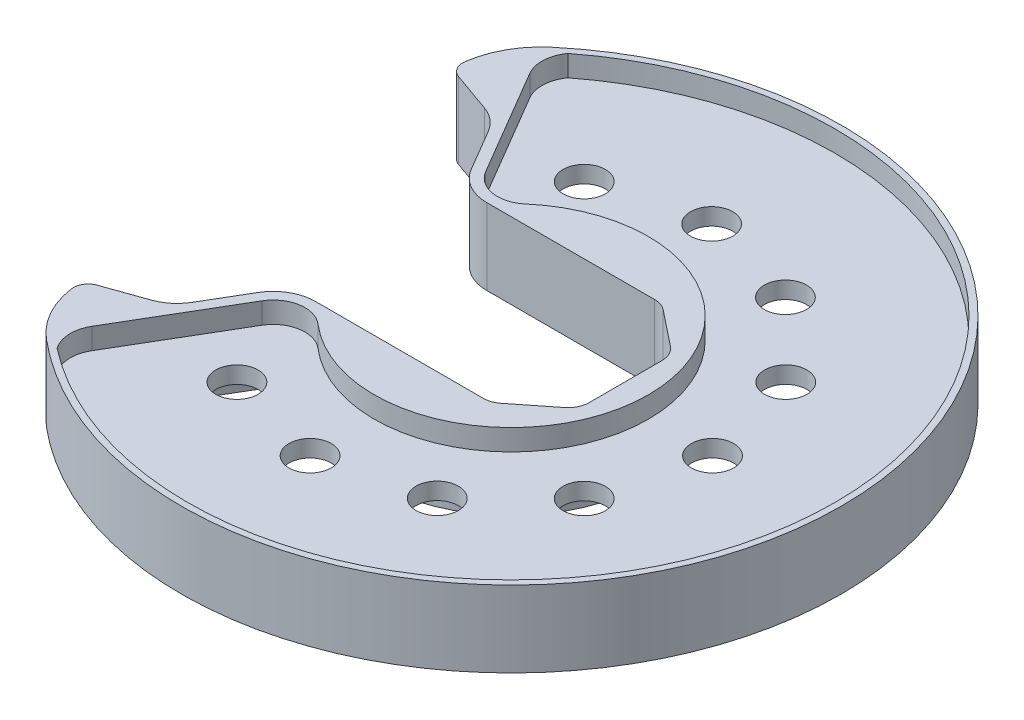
SolidWorks part; units mm, degrees
other "<lowerBatteryTray>-<#10 (0.1935) Diameter Hole1>"
ref_plane "Front Plane" through (0, 0, 0) normal (0, 0, 1) x (1, 0, 0)
ref_plane "Top Plane" through (0, 0, 0) normal (0, 1, 0) x (1, 0, 0)
ref_plane "Right Plane" through (0, 0, 0) normal (1, 0, 0) x (0, 0, -1)
ref_plane "Front Plane-lowerBatteryTray_Mirrored" through (0, 0, 0) normal (0, 0, 1) x (1, 0, 0)
ref_plane "Top Plane-lowerBatteryTray_Mirrored" through (0, 0, 0) normal (0, -1, 0) x (1, 0, 0)
ref_plane "Right Plane-lowerBatteryTray_Mirrored" through (0, 0, 0) normal (1, 0, 0) x (0, 0, -1)
sketch "Sketch1-lowerBatteryTray_Mirrored" plane through (0, 0, 0) normal (0, 1, 0) x (1, 0, 0)
  line L0 (0, 0) -> (34.29, 0) construction
  line L8 (34.29, -13.97) -> (34.29, 13.97)
  line L12 (19.5169, 25.7024) -> (34.29, 13.97)
  line L15 (19.5169, -25.7024) -> (-33.0714, -25.7024)
  line L16 (19.5169, -25.7024) -> (34.29, -13.97)
  line L18 (19.5169, 25.7024) -> (-33.0714, 25.7024)
  line L20 (-67.7301, 72.2877) -> (-44.019, 31.9649)
  line L22 (-67.7301, -72.2877) -> (-44.019, -31.9649)
  line L24 (-59.5332, 66.1151) -> (-42.881, 37.7966) construction
  line L25 (-60.19, 65.7288) -> (-41.2821, 33.5742)
  line L26 (-60.19, -65.7288) -> (-41.2821, -33.5742)
  line L27 (41.155, 0) -> (97.155, 0) construction
  arc A0 (-67.7301, -72.2877) -> (-67.7301, 72.2877) centre (0, 0) ccw
  arc A3 (-59.6737, 76.669) -> (-59.6737, -76.669) centre (0, 0) cw
  arc A4 (-49.772, 48.0121) -> (-49.772, -48.0121) centre (0, 0) cw construction
  arc A5 (-26.8559, 31.1849) -> (-41.2821, 33.5742) centre (-33.0714, 38.4024) cw
  arc A6 (-44.019, 31.9649) -> (-33.0714, 25.7024) centre (-33.0714, 38.4024) ccw
  arc A11 (-44.019, -31.9649) -> (-33.0714, -25.7024) centre (-33.0714, -38.4024) cw
  arc A14 (-59.6737, 76.669) -> (-60.19, 65.7288) centre (-51.5596, 70.8038) ccw
  arc A16 (-41.2821, -33.5742) -> (-26.8559, -31.1849) centre (-33.0714, -38.4024) cw
  arc A17 (-59.6737, -76.669) -> (-60.19, -65.7288) centre (-51.5596, -70.8038) cw
  arc A18 (-26.8559, 31.1849) -> (-26.8559, -31.1849) centre (0, 0) cw
  point P23 (-33.0714, -25.4)
  point P24 (-33.0714, -25.4)
  point P48 (69.155, 0)
  dimension "D1" = 198.12
  dimension "D4" = 34.29
  dimension "D5" = 1.905
  dimension "D6" = 9.525
  dimension "D11" = 56
  dimension "D3" = 27.94
  dimension "D8" = 0.762
  dimension "D9" = 3.175
  dimension "D13" = 56
  dimension "D14" = 8.89
sketch "Sketch4-lowerBatteryTray_Mirrored" plane through (0, 0, 0) normal (0, -1, 0) x (1, 0, 0)
  line L8 (19.5169, -25.7024) -> (-33.0714, -25.7024)
  line L10 (-33.0714, 25.7024) -> (19.5169, 25.7024)
  line L39 (19.5169, 25.7024) -> (34.29, 13.97)
  line L40 (34.29, 13.97) -> (34.29, -13.97)
  line L41 (34.29, -13.97) -> (19.5169, -25.7024)
  line L44 (-44.019, -31.9649) -> (-67.7301, -72.2877)
  line L45 (-67.7301, 72.2877) -> (-44.019, 31.9649)
  arc A4 (-33.0714, -25.7024) -> (-44.019, -31.9649) centre (-33.0714, -38.4024) ccw
  arc A6 (-44.019, 31.9649) -> (-33.0714, 25.7024) centre (-33.0714, 38.4024) ccw
  arc A19 (-67.7301, -72.2877) -> (-67.7301, 72.2877) centre (0, 0) ccw
sketch "Sketch5-lowerBatteryTray_Mirrored" plane through (0, -16.51, 0) normal (0, 1, 0) x (1, 0, 0)
  line L0 (-70.0632, 54.2298) -> (-58.0703, 49.9846)
  line L2 (-51.3606, 44.45) -> (-65.0836, 67.787)
  arc A3 (-72.9842, 59.0206) -> (-63.6926, 75.8692) centre (-46.5184, 55.4117) cw
  arc A4 (-58.0703, 49.9846) -> (-51.3606, 44.45) centre (-62.3082, 38.0125) cw
  arc A5 (-63.6926, 75.8692) -> (-65.0836, 67.787) centre (-59.6098, 71.0058) ccw
  arc A7 (-72.9842, 59.0206) -> (-70.0632, 54.2298) centre (-68.58, 58.42) ccw
  point P6 (-62.4537, 75.8692)
  point P11 (-73.025, 58.42)
  point P13 (-64.8838, 67.4473)
  dimension "D1" = 4.445
  dimension "D3" = 12.7
mirrored part "lowerBatteryTray_Mirrored"
sketch "Sketch4" plane through (0, 0, 0) normal (0, 1, 0) x (1, 0, 0)
  line L11 (-33.0714, 25.7024) -> (17.3021, 25.7024)
  line L12 (-33.0714, 25.7024) -> (17.3021, 25.7024)
  line L13 (-58.0703, -49.9846) -> (-70.0632, -54.2298)
  line L17 (-58.0703, -49.9846) -> (-70.0632, -54.2298)
  line L18 (-70.0632, 54.2298) -> (-58.0703, 49.9846)
  line L19 (-70.0632, 54.2298) -> (-58.0703, 49.9846)
  line L20 (-41.2821, -33.5742) -> (-60.19, -65.7288)
  line L21 (-60.19, 65.7288) -> (-41.2821, 33.5742)
  line L22 (-41.2821, -33.5742) -> (-60.19, -65.7288)
  line L23 (-60.19, 65.7288) -> (-41.2821, 33.5742)
  line L24 (17.3021, -25.7024) -> (-33.0714, -25.7024)
  line L25 (31.8891, -15.8767) -> (21.2513, -24.325)
  line L26 (17.3021, -25.7024) -> (-33.0714, -25.7024)
  line L37 (-44.019, -31.9649) -> (-51.3606, -44.45)
  line L41 (-44.019, -31.9649) -> (-51.3606, -44.45)
  line L43 (-51.3606, 44.45) -> (-44.019, 31.9649)
  line L44 (21.2513, 24.325) -> (31.8891, 15.8767)
  line L45 (34.29, 10.9041) -> (34.29, -10.9041)
  line L46 (31.8891, -15.8767) -> (21.2513, -24.325)
  line L53 (21.2513, 24.325) -> (31.8891, 15.8767)
  line L54 (34.29, 10.9041) -> (34.29, -10.9041)
  line L55 (-51.3606, 44.45) -> (-44.019, 31.9649)
  arc A6 (-41.2821, 33.5742) -> (-26.8559, 31.1849) centre (-33.0714, 38.4024) ccw
  arc A7 (-41.2821, 33.5742) -> (-26.8559, 31.1849) centre (-33.0714, 38.4024) ccw
  arc A12 (-44.019, 31.9649) -> (-33.0714, 25.7024) centre (-33.0714, 38.4024) ccw
  arc A13 (-44.019, 31.9649) -> (-33.0714, 25.7024) centre (-33.0714, 38.4024) ccw
  arc A17 (-33.0714, -25.7024) -> (-44.019, -31.9649) centre (-33.0714, -38.4024) ccw
  arc A18 (-33.0714, -25.7024) -> (-44.019, -31.9649) centre (-33.0714, -38.4024) ccw
  arc A19 (-63.6926, -75.8692) -> (-63.6926, 75.8692) centre (0, 0) ccw
  arc A22 (-63.6926, -75.8692) -> (-63.6926, 75.8692) centre (0, 0) ccw
  arc A34 (-70.0632, -54.2298) -> (-72.9842, -59.0206) centre (-68.58, -58.42) ccw
  arc A37 (-70.0632, -54.2298) -> (-72.9842, -59.0206) centre (-68.58, -58.42) ccw
  arc A39 (-58.0703, -49.9846) -> (-51.3606, -44.45) centre (-62.3082, -38.0125) ccw
  arc A41 (-58.0703, -49.9846) -> (-51.3606, -44.45) centre (-62.3082, -38.0125) ccw
  arc A42 (-72.9842, 59.0206) -> (-70.0632, 54.2298) centre (-68.58, 58.42) ccw
  arc A44 (-72.9842, 59.0206) -> (-70.0632, 54.2298) centre (-68.58, 58.42) ccw
  arc A46 (-59.6737, 76.669) -> (-60.19, 65.7288) centre (-51.5596, 70.8038) ccw
  arc A47 (-59.6737, -76.669) -> (-59.6737, 76.669) centre (0, 0) ccw
  arc A48 (-60.19, -65.7288) -> (-59.6737, -76.669) centre (-51.5596, -70.8038) ccw
  arc A49 (-26.8559, -31.1849) -> (-41.2821, -33.5742) centre (-33.0714, -38.4024) ccw
  arc A50 (-26.8559, -31.1849) -> (-26.8559, 31.1849) centre (0, 0) ccw
  arc A52 (-59.6737, 76.669) -> (-60.19, 65.7288) centre (-51.5596, 70.8038) ccw
  arc A53 (-59.6737, -76.669) -> (-59.6737, 76.669) centre (0, 0) ccw
  arc A54 (-60.19, -65.7288) -> (-59.6737, -76.669) centre (-51.5596, -70.8038) ccw
  arc A55 (-26.8559, -31.1849) -> (-41.2821, -33.5742) centre (-33.0714, -38.4024) ccw
  arc A56 (-26.8559, -31.1849) -> (-26.8559, 31.1849) centre (0, 0) ccw
  arc A60 (21.2513, 24.325) -> (17.3021, 25.7024) centre (17.3021, 19.3524) ccw
  arc A62 (-51.3606, 44.45) -> (-58.0703, 49.9846) centre (-62.3082, 38.0125) ccw
  arc A63 (-51.3606, 44.45) -> (-58.0703, 49.9846) centre (-62.3082, 38.0125) ccw
  arc A65 (21.2513, 24.325) -> (17.3021, 25.7024) centre (17.3021, 19.3524) ccw
  arc A67 (17.3021, -25.7024) -> (21.2513, -24.325) centre (17.3021, -19.3524) ccw
  arc A69 (34.29, 10.9041) -> (31.8891, 15.8767) centre (27.94, 10.9041) ccw
  arc A70 (34.29, 10.9041) -> (31.8891, 15.8767) centre (27.94, 10.9041) ccw
  arc A71 (31.8891, -15.8767) -> (34.29, -10.9041) centre (27.94, -10.9041) ccw
  arc A72 (31.8891, -15.8767) -> (34.29, -10.9041) centre (27.94, -10.9041) ccw
  arc A73 (17.3021, -25.7024) -> (21.2513, -24.325) centre (17.3021, -19.3524) ccw
  arc A79 (-72.9842, -59.0206) -> (-63.6926, -75.8692) centre (-46.5184, -55.4117) ccw
  arc A80 (-72.9842, -59.0206) -> (-63.6926, -75.8692) centre (-46.5184, -55.4117) ccw
  arc A81 (-63.6926, 75.8692) -> (-72.9842, 59.0206) centre (-46.5184, 55.4117) ccw
  arc A82 (-63.6926, 75.8692) -> (-72.9842, 59.0206) centre (-46.5184, 55.4117) ccw
  dimension "D1" = 0
  dimension "D2" = 0
extrude "Boss-Extrude1" add sketch "Sketch4" along normal blind 6.35
sketch "Sketch5" plane through (0, 0, 0) normal (0, 1, 0) x (1, 0, 0)
  line L0 (-25.6444, 44.2686) -> (-34.857, 59.9809) construction
  line L1 (-0.0744, 51.1599) -> (-0.1966, 69.3735) construction
  line L2 (25.5155, 44.343) -> (34.5165, 60.1775) construction
  line L3 (44.2686, 25.6444) -> (59.9809, 34.857) construction
  line L4 (51.1599, 0.0744) -> (69.3735, 0.1966) construction
  line L5 (0, 0) -> (-32.942, 0) construction
  circle A0 centre (-30.2507, 52.1247) radius 6.35
  arc A4 (-32.942, 39.143) -> (-17.5677, 48.0492) centre (0, 0) cw construction
  arc A5 (-42.3879, 54.918) -> (-26.7297, 64.0175) centre (0, 0) cw construction
  arc A6 (-26.8559, -31.1849) -> (-26.8559, 31.1849) centre (0, 0) ccw construction
  arc A7 (-9.25, 68.7543) -> (8.8601, 68.8056) centre (0, 0) cw construction
  circle A8 centre (-0.1355, 60.2667) radius 6.35
  circle A9 centre (30.016, 52.2603) radius 6.35
  arc A10 (17.4278, 48.1001) -> (32.828, 39.2386) centre (0, 0) cw construction
  arc A11 (26.3664, 64.168) -> (42.0759, 55.1574) centre (0, 0) cw construction
  arc A12 (54.918, 42.3879) -> (64.0175, 26.7297) centre (0, 0) cw construction
  circle A13 centre (52.1247, 30.2507) radius 6.35
  circle A14 centre (60.2667, 0.1355) radius 6.35
  arc A15 (50.3698, 8.9571) -> (50.3956, -8.8106) centre (0, 0) cw construction
  arc A16 (68.7543, 9.25) -> (68.8056, -8.8601) centre (0, 0) cw construction
  circle A17 centre (52.1247, -30.2507) radius 6.35
  circle A19 centre (64.0175, 26.7297) radius 9.25 construction
  circle A20 centre (54.918, 42.3879) radius 9.25 construction
  circle A21 centre (44.2686, 25.6444) radius 9.25 construction
  circle A22 centre (42.0759, 55.1574) radius 9.25 construction
  circle A23 centre (26.3664, 64.168) radius 9.25 construction
  circle A24 centre (32.828, 39.2386) radius 9.25 construction
  circle A25 centre (17.4278, 48.1001) radius 9.25 construction
  circle A28 centre (68.8056, -8.8601) radius 9.25 construction
  circle A29 centre (68.7543, 9.25) radius 9.25 construction
  circle A30 centre (50.3698, 8.9571) radius 9.25 construction
  circle A31 centre (50.3956, -8.8106) radius 9.25 construction
  circle A32 centre (30.016, -52.2603) radius 6.35
  circle A33 centre (-0.1355, -60.2667) radius 6.35
  circle A34 centre (-30.2507, -52.1247) radius 6.35
  dimension "D1" = 12.7
  dimension "D2" = 12.7
  dimension "D3" = 12.7
extrude "Cut-Extrude1" cut sketch "Sketch5" against normal through all
